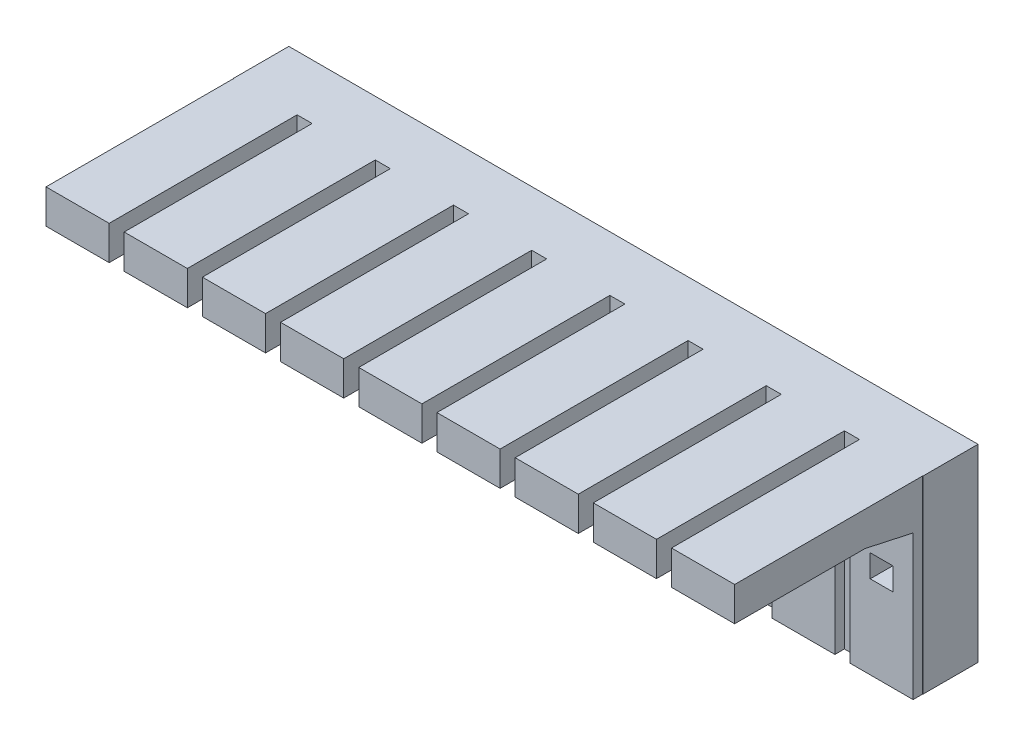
SolidWorks part; units mm, degrees
ref_plane "Front Plane" through (0, 0, 0) normal (0, 0, 1) x (1, 0, 0)
ref_plane "Top Plane" through (0, 0, 0) normal (0, 1, 0) x (1, 0, 0)
ref_plane "Right Plane" through (0, 0, 0) normal (1, 0, 0) x (0, 0, -1)
sketch "Sketch1" plane through (0, 0, 0) normal (1, 0, 0) x (0, 0, -1)
  line L0 (0, 0) -> (0, 9.5758)
  line L1 (0, 9.5758) -> (-12.319, 9.5758)
  line L2 (-12.319, 9.5758) -> (-12.319, 7.8486)
  line L3 (-12.319, 7.8486) -> (-5.715, 7.8486)
  line L4 (-5.715, 7.8486) -> (-3.2766, 7.3152)
  line L5 (-3.2766, 7.3152) -> (-3.2766, 0)
  line L6 (-3.2766, 0) -> (0, 0)
  dimension "D1" = 12.319
  dimension "D2" = 9.5758
  dimension "D3" = 3.2766
  dimension "D4" = 1.7272
  dimension "D5" = 2.2606
  dimension "D6" = 2.4384
extrude "Boss-Extrude1" add sketch "Sketch1" along normal mid plane 34.925
sketch "Sketch2" plane through (0, 9.5758, 0) normal (0, 1, 0) x (1, 0, 0)
  line L0 (17.4625, -12.319) -> (-17.4625, -12.319) construction
  line L1 (1.6002, -12.319) -> (2.3622, -12.319)
  line L2 (1.6002, -12.319) -> (1.6002, -2.794)
  line L3 (1.6002, -2.794) -> (2.3622, -2.794)
  line L4 (2.3622, -12.319) -> (2.3622, -2.794)
  line L5 (0, 0) -> (0, -16.9847) construction
  line L6 (17.4625, 0) -> (-17.4625, 0) construction
  point P10 (1.9812, -12.319)
  dimension "D1" = 0.762
  dimension "D2" = 3.9624
  dimension "D3" = 9.525
extrude "Cut-Extrude1" cut sketch "Sketch2" against normal through all
pattern_linear "LPattern1" count 5 spacing 3.9624 along (1, 0, 0) of "Cut-Extrude1"
mirror "Mirror1" about plane through (0, 0, 0) normal (1, 0, 0) of "LPattern1", "Cut-Extrude1"
sketch "Sketch3" plane through (0, 0, 3.2766) normal (0, 0, 1) x (1, 0, 0)
  line L0 (0, 0) -> (0, 19.6401) construction
  line L1 (1.6002, 0) -> (-1.6002, 0) construction
  line L3 (-0.5715, 4.2164) -> (0.5715, 4.2164)
  line L4 (-0.5715, 4.2164) -> (-0.5715, 5.3594)
  line L5 (-0.5715, 5.3594) -> (0.5715, 5.3594)
  line L6 (0.5715, 4.2164) -> (0.5715, 5.3594)
  line L7 (-0.5715, 4.2164) -> (0.5715, 5.3594) construction
  line L8 (-0.5715, 5.3594) -> (0.5715, 4.2164) construction
  point P4 (0, 4.7879)
  dimension "D1" = 1.143
  dimension "D2" = 1.143
  dimension "D3" = 4.2164
extrude "Cut-Extrude2" cut sketch "Sketch3" against normal through all
pattern_linear "LPattern2" count 5 spacing 3.9624 along (-1, 0, 0) count 5 spacing 3.9624 along (1, 0, 0) of "Cut-Extrude2"
